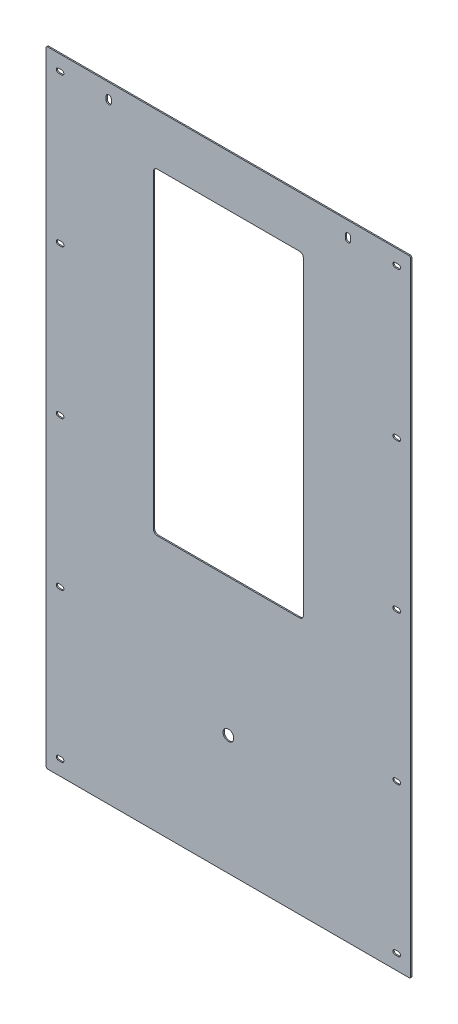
SolidWorks part; units mm, degrees
ref_plane "Ebene vorne" through (0, 0, 0) normal (0, 0, 1) x (1, 0, 0)
ref_plane "Ebene oben" through (0, 0, 0) normal (0, 1, 0) x (1, 0, 0)
ref_plane "Ebene rechts" through (0, 0, 0) normal (1, 0, 0) x (0, 0, -1)
sketch "Skizze1" plane through (0, 0, 0) normal (0, 0, 1) x (1, 0, 0)
  line L1 (-228.5, -392) -> (228.5, -392)
  line L2 (-228.5, -392) -> (-228.5, 392)
  line L3 (-228.5, 392) -> (228.5, 392)
  line L4 (228.5, -392) -> (228.5, 392)
  line L5 (-228.5, -392) -> (228.5, 392) construction
  line L6 (-228.5, 392) -> (228.5, -392) construction
  point P0 (0, 0)
  dimension "D1" = 457
  dimension "D2" = 784
extrude "Aufsatz-Linear austragen1" add sketch "Skizze1" along normal blind 1.5
sketch "Skizze2" plane through (0, 0, 1.5) normal (0, 0, 1) x (1, 0, 0)
  line L0 (228.5, 392) -> (-228.5, 392) construction
  line L1 (-89, -70) -> (89, -70)
  line L2 (-94, -65) -> (-94, 323)
  line L3 (-89, 328) -> (89, 328)
  line L4 (94, -65) -> (94, 323)
  line L5 (-94, -70) -> (94, 328) construction
  line L6 (-94, 328) -> (94, -70) construction
  arc A0 (94, -65) -> (89, -70) centre (89, -65) cw
  arc A1 (-94, -65) -> (-89, -70) centre (-89, -65) ccw
  arc A2 (94, 323) -> (89, 328) centre (89, 323) ccw
  arc A3 (-89, 328) -> (-94, 323) centre (-89, 323) ccw
  point P0 (0, 129)
  dimension "D3" = 5
  dimension "D1" = 188
  dimension "D2" = 64
  dimension "D4" = 70
extrude "Schnitt-Linear austragen1" cut sketch "Skizze2" against normal through all
hole_wizard "Durchgangsloch für M51" positions "Skizze3" profile "Skizze4" hole size "M5" standard "DIN"
sketch "Skizze3" plane through (0, 0, 1.5) normal (0, 0, 1) x (1, 0, 0)
  line L0 (-211, 373) -> (-211, 0) construction
  line L1 (-211, 0) -> (-211, -373) construction
  line L2 (-211, -373) -> (211, -373) construction
  line L3 (211, -373) -> (211, 0) construction
  line L4 (211, 0) -> (211, 373) construction
  line L5 (211, 373) -> (-211, 373) construction
  line L7 (0, 0) -> (0, 373) construction
  line L9 (228.5, 392) -> (-228.5, 392) construction
  line L10 (228.5, -392) -> (228.5, 392) construction
  line L11 (-228.5, -392) -> (228.5, -392) construction
  point P1 (-211, 373)
  point P2 (-211, 0)
  point P4 (-211, -373)
  point P6 (211, -373)
  point P8 (211, 0)
  point P10 (211, 373)
  point P30 (211, 186.5)
  point P32 (211, -186.5)
  point P34 (-211, -186.5)
  point P36 (-211, 186.5)
  dimension "D1" = 19
  dimension "D2" = 17.5
  dimension "D3" = 19
sketch "Skizze4" plane through (-211, 373, 1.5) normal (1, 0, 0) x (0, -1, 0)
  line L0 (0, 0) -> (0, 1.5)
  line L1 (0, 1.5) -> (2.75, 1.5)
  line L2 (2.75, 1.5) -> (2.75, 0)
  line L5 (2.75, 0) -> (0, 0)
  line L11 (0, -6.35) -> (0, 107.95) construction
  dimension "Bohrerdurchmesser" = 5.5
  dimension "Bohrungstiefe" = 1.5
sketch "Skizze6" plane through (0, 0, 1.5) normal (0, 0, 1) x (1, 0, 0)
  line L0 (0, 0) -> (0, 452.7519) construction
  line L1 (213, 373) -> (209, 373) construction
  line L2 (213, 370.25) -> (209, 370.25)
  line L3 (213, 375.75) -> (209, 375.75)
  line L4 (213, 186.5) -> (209, 186.5) construction
  line L5 (213, 183.75) -> (209, 183.75)
  line L6 (213, 189.25) -> (209, 189.25)
  line L7 (213, 0) -> (209, 0) construction
  line L8 (213, -2.75) -> (209, -2.75)
  line L9 (213, 2.75) -> (209, 2.75)
  line L10 (213, -186.5) -> (209, -186.5) construction
  line L11 (213, -189.25) -> (209, -189.25)
  line L12 (213, -183.75) -> (209, -183.75)
  line L13 (213, -373) -> (209, -373) construction
  line L14 (213, -375.75) -> (209, -375.75)
  line L15 (213, -370.25) -> (209, -370.25)
  line L16 (-213, 373) -> (-209, 373) construction
  line L17 (-213, 370.25) -> (-209, 370.25)
  line L18 (-213, 375.75) -> (-209, 375.75)
  line L19 (-213, 186.5) -> (-209, 186.5) construction
  line L20 (-213, 183.75) -> (-209, 183.75)
  line L21 (-213, 189.25) -> (-209, 189.25)
  line L22 (-213, 0) -> (-209, 0) construction
  line L23 (-213, -2.75) -> (-209, -2.75)
  line L24 (-213, 2.75) -> (-209, 2.75)
  line L25 (-213, -186.5) -> (-209, -186.5) construction
  line L26 (-213, -189.25) -> (-209, -189.25)
  line L27 (-213, -183.75) -> (-209, -183.75)
  line L28 (-213, -373) -> (-209, -373) construction
  line L29 (-213, -375.75) -> (-209, -375.75)
  line L30 (-213, -370.25) -> (-209, -370.25)
  arc A3 (213, 370.25) -> (213, 375.75) centre (213, 373) ccw
  arc A4 (209, 375.75) -> (209, 370.25) centre (209, 373) ccw
  circle A5 centre (211, 373) radius 2.75 construction
  arc A6 (213, 183.75) -> (213, 189.25) centre (213, 186.5) ccw
  arc A7 (209, 189.25) -> (209, 183.75) centre (209, 186.5) ccw
  arc A8 (213, -2.75) -> (213, 2.75) centre (213, 0) ccw
  arc A9 (209, 2.75) -> (209, -2.75) centre (209, 0) ccw
  arc A10 (213, -189.25) -> (213, -183.75) centre (213, -186.5) ccw
  arc A11 (209, -183.75) -> (209, -189.25) centre (209, -186.5) ccw
  arc A12 (213, -375.75) -> (213, -370.25) centre (213, -373) ccw
  arc A13 (209, -370.25) -> (209, -375.75) centre (209, -373) ccw
  arc A14 (-213, 370.25) -> (-213, 375.75) centre (-213, 373) cw
  arc A15 (-209, 375.75) -> (-209, 370.25) centre (-209, 373) cw
  arc A16 (-213, 183.75) -> (-213, 189.25) centre (-213, 186.5) cw
  arc A17 (-209, 189.25) -> (-209, 183.75) centre (-209, 186.5) cw
  arc A18 (-213, -2.75) -> (-213, 2.75) centre (-213, 0) cw
  arc A19 (-209, 2.75) -> (-209, -2.75) centre (-209, 0) cw
  arc A20 (-213, -189.25) -> (-213, -183.75) centre (-213, -186.5) cw
  arc A21 (-209, -183.75) -> (-209, -189.25) centre (-209, -186.5) cw
  arc A22 (-213, -375.75) -> (-213, -370.25) centre (-213, -373) cw
  arc A23 (-209, -370.25) -> (-209, -375.75) centre (-209, -373) cw
  point P4 (211, 373)
  point P13 (211, 186.5)
  point P19 (211, 0)
  point P26 (211, -186.5)
  point P34 (211, -373)
  point P42 (-211, 373)
  point P49 (-211, 186.5)
  point P56 (-211, 0)
  point P69 (-211, -186.5)
  point P76 (-211, -373)
  dimension "D1" = 4
extrude "Schnitt-Linear austragen3" cut sketch "Skizze6" against normal through all
fillet "Verrundung2" radius 2
sketch "Skizze7" [suppressed] plane through (0, 0, 1.5) normal (0, 0, 1) x (1, 0, 0)
  circle A0 centre (0, 270) radius 25.25
  dimension "D1" = 50.5
  dimension "D2" = 270
extrude "Schnitt-Linear austragen4" [suppressed] cut sketch "Skizze7" against normal through all
hole_wizard "Durchgangsloch für M61" positions "Skizze10" profile "Skizze11" hole size "M6" standard "DIN"
sketch "Skizze10" plane through (0, 0, 1.5) normal (0, 0, 1) x (1, 0, 0)
  line L0 (0, 0) -> (0, 527.3929) construction
  line L2 (226.5, 392) -> (-226.5, 392) construction
  point P0 (-150, 373)
  point P2 (150, 373)
  dimension "D1" = 19
  dimension "D2" = 300
sketch "Skizze11" plane through (-150, 373, 1.5) normal (1, 0, 0) x (0, -1, 0)
  line L0 (0, 0) -> (0, 1.5)
  line L1 (0, 1.5) -> (3.3, 1.5)
  line L2 (3.3, 1.5) -> (3.3, 0)
  line L5 (3.3, 0) -> (0, 0)
  line L11 (0, -6.35) -> (0, 107.95) construction
  dimension "Bohrerdurchmesser" = 6.6
  dimension "Bohrungstiefe" = 1.5
sketch "Skizze12" plane through (0, 0, 1.5) normal (0, 0, 1) x (1, 0, 0)
  line L0 (-150, 371) -> (-150, 375) construction
  line L1 (-153.3, 371) -> (-153.3, 375)
  line L2 (-146.7, 371) -> (-146.7, 375)
  line L3 (150, 371) -> (150, 375) construction
  line L4 (146.7, 371) -> (146.7, 375)
  line L5 (153.3, 371) -> (153.3, 375)
  arc A0 (-153.3, 371) -> (-146.7, 371) centre (-150, 371) ccw
  arc A1 (-146.7, 375) -> (-153.3, 375) centre (-150, 375) ccw
  arc A2 (146.7, 371) -> (153.3, 371) centre (150, 371) ccw
  arc A3 (153.3, 375) -> (146.7, 375) centre (150, 375) ccw
  circle A4 centre (150, 373) radius 3.3 construction
  point P2 (-150, 373)
  point P9 (150, 373)
  dimension "D1" = 4
extrude "Schnitt-Linear austragen5" cut sketch "Skizze12" against normal through all
sketch "Skizze13" plane through (0, 0, 1.5) normal (0, 0, 1) x (1, 0, 0)
  line L0 (-226.5, -392) -> (226.5, -392) construction
  circle A0 centre (0, -242) radius 6.7
  dimension "D1" = 13.4
  dimension "D2" = 150
extrude "Schnitt-Linear austragen6" cut sketch "Skizze13" against normal blind 10
hole_wizard "Durchgangsloch für M52" positions "Skizze14" profile "Skizze15" hole size "M5" standard "DIN"
sketch "Skizze14" plane through (0, 0, 1.5) normal (0, 0, 1) x (1, 0, 0)
  line L0 (0, 40) -> (110, 175) construction
  line L1 (110, 175) -> (-110, 175) construction
  line L2 (-110, 175) -> (0, 40) construction
  line L4 (0, 40) -> (0, -118.679) construction
  point P0 (0, 40)
  point P20 (-44, 175)
  point P22 (44, 175)
  dimension "D1" = 220
  dimension "D2" = 135
  dimension "D3" = 40
  dimension "D4" = 88
sketch "Skizze15" plane through (0, 40, 1.5) normal (1, 0, 0) x (0, -1, 0)
  line L0 (0, 0) -> (0, 1.5)
  line L1 (0, 1.5) -> (2.75, 1.5)
  line L2 (2.75, 1.5) -> (2.75, 0)
  line L5 (2.75, 0) -> (0, 0)
  line L11 (0, -6.35) -> (0, 107.95) construction
  dimension "Bohrerdurchmesser" = 5.5
  dimension "Bohrungstiefe" = 1.5
